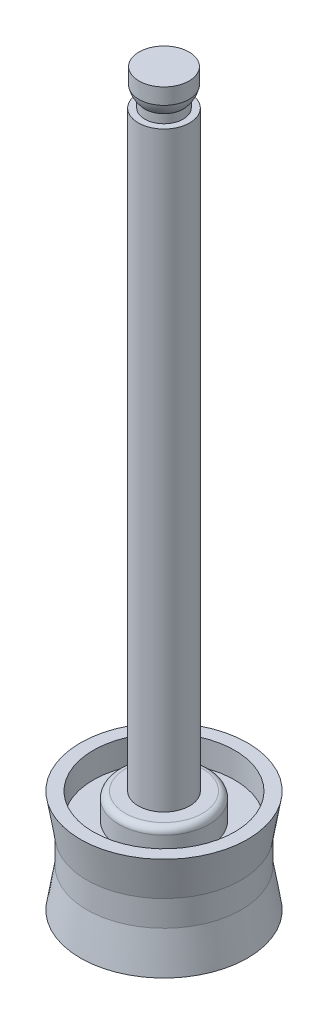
SolidWorks part; units mm, degrees
ref_plane "前视基准面" through (0, 0, 0) normal (0, 0, 1) x (1, 0, 0)
ref_plane "上视基准面" through (0, 0, 0) normal (0, 1, 0) x (1, 0, 0)
ref_plane "右视基准面" through (0, 0, 0) normal (1, 0, 0) x (0, 0, -1)
sketch "草图1" plane through (0, 0, 0) normal (0, 1, 0) x (1, 0, 0)
  circle A0 centre (0, 0) radius 6.5
  dimension "D1" = 13
extrude "凸台-拉伸1" add sketch "草图1" along normal blind 8
sketch "草图2" plane through (0, 8, 0) normal (0, 1, 0) x (1, 0, 0)
  circle A0 centre (0, 0) radius 2
  dimension "D1" = 4
extrude "凸台-拉伸2" add sketch "草图2" along normal blind 46
sketch "草图4" plane through (0, 0, 0) normal (0, 0, 1) x (1, 0, 0)
  line L0 (0, 54) -> (0, 56)
  line L1 (0, 56.8) -> (1.95, 56.8)
  line L2 (2, 54) -> (-2, 54) construction
  line L3 (0, 56) -> (0, 56.8)
  line L4 (1.95, 56.8) -> (1.95, 55.5556)
  line L5 (0, 54) -> (1.5, 54)
  line L6 (1.5, 54) -> (1.5, 54.6771)
  arc A1 (1.5, 54.6771) -> (1.95, 55.5556) centre (0, 56) ccw
  dimension "D1" = 2
  dimension "D2" = 0.8
  dimension "D3" = 1.95
  dimension "D4" = 1.5
revolve "旋转1" add sketch "草图4" angle 360 about L0
sketch "草图5" plane through (0, 0, 0) normal (0, 0, 1) x (1, 0, 0)
  line L0 (-6.5, 8) -> (-6.5, 5)
  line L1 (-6.5, 8) -> (-6.5, 0) construction
  line L2 (-6.5, 5) -> (-6.5, 3)
  line L3 (-6.5, 3) -> (-6.5, 0)
  line L4 (-6, 5) -> (-6, 3)
  line L5 (0, 0) -> (0, 8) construction
  line L6 (-6.5, 8) -> (-6, 5)
  line L7 (-6.5, 0) -> (-6, 3)
  line L8 (6.5, 8) -> (-6.5, 8) construction
  dimension "D1" = 3
  dimension "D2" = 3
  dimension "D3" = 0.5
  dimension "D4" = 0.5
revolve "切除-旋转1" cut sketch "草图5" angle 360 about L5
sketch "草图6" plane through (0, 0, 0) normal (0, -1, 0) x (1, 0, 0)
  circle A0 centre (0, 0) radius 3.5
  circle A1 centre (0, 0) radius 5.5
  dimension "D1" = 11
  dimension "D2" = 7
extrude "切除-拉伸1" cut sketch "草图6" against normal blind 2
sketch "草图7" plane through (0, 8, 0) normal (0, 1, 0) x (1, 0, 0)
  circle A0 centre (0, 0) radius 5.5
  circle A1 centre (0, 0) radius 3.5
  dimension "D1" = 11
  dimension "D2" = 7
extrude "切除-拉伸2" cut sketch "草图7" against normal blind 2
fillet "圆角2" radius 0.5 2 edges at (0, 0, -3.5) (0, 8, 3.5)
